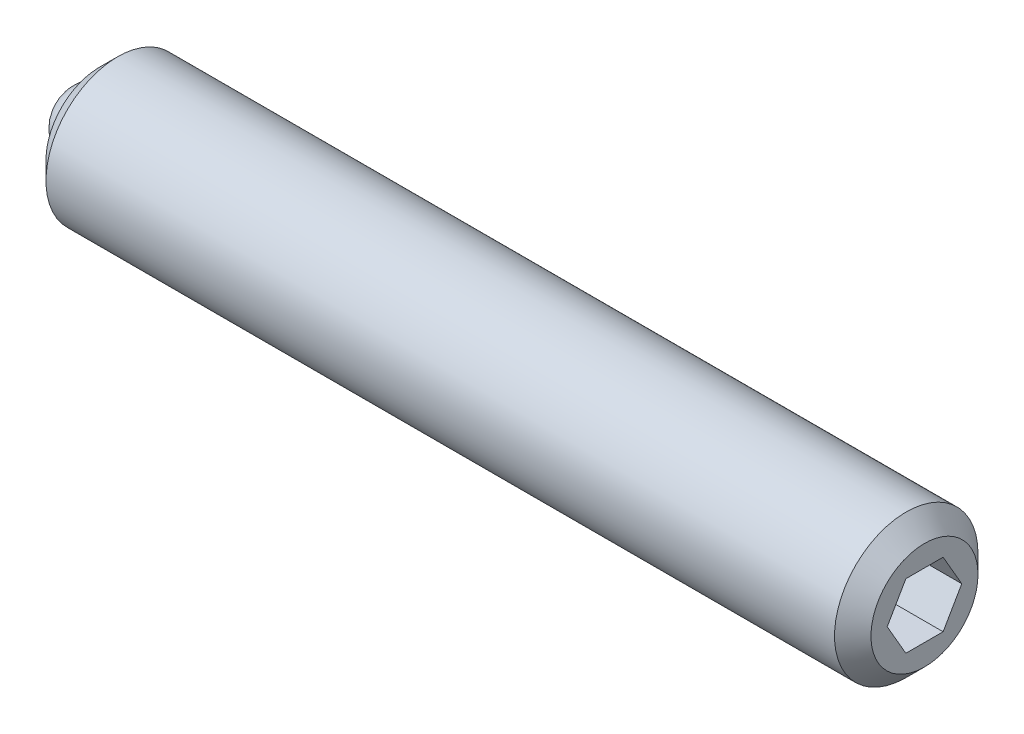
SolidWorks part; units mm, degrees
ref_plane "Front Plane" through (0, 0, 0) normal (0, 0, 1) x (1, 0, 0)
ref_plane "Top Plane" through (0, 0, 0) normal (0, 1, 0) x (1, 0, 0)
ref_plane "Right Plane" through (0, 0, 0) normal (1, 0, 0) x (0, 0, -1)
sketch "Sketch2" plane through (0, 0, 0) normal (1, 0, 0) x (0, 0, -1)
  circle A0 centre (0, 0) radius 1
  dimension "D1" = 2
extrude "Boss-Extrude1" add sketch "Sketch2" along normal blind 11.5
sketch "Sketch3" plane through (0, 0, 0) normal (-1, 0, 0) x (0, 0, 1)
  circle A0 centre (0, 0) radius 0.5
  dimension "D1" = 1
chamfer "Chamfer1" distance 0.254 angle 45 1 edges at (0, 0, -1)
chamfer "Chamfer2" distance 0.254 angle 45 1 edges at (11.5, 0, -1)
sketch "Sketch4" plane through (11.5, 0, 0) normal (1, 0, 0) x (0, 0, -1)
  line L1 (0.5196, 0) -> (0.2598, 0.45)
  line L2 (0.2598, 0.45) -> (-0.2598, 0.45)
  line L3 (-0.2598, 0.45) -> (-0.5196, 0)
  line L4 (-0.5196, 0) -> (-0.2598, -0.45)
  line L5 (-0.2598, -0.45) -> (0.2598, -0.45)
  line L6 (0.2598, -0.45) -> (0.5196, 0)
  circle A0 centre (0, 0) radius 0.45 construction
  dimension "D1" = 0.9
extrude "Cut-Extrude2" cut sketch "Sketch4" against normal blind 2
extrude "Cut-Extrude3" cut sketch "Sketch3" against normal blind 0.5
sketch "Sketch5" plane through (0, 0, 0) normal (-1, 0, 0) x (0, 0, 1)
  line L0 (0, 0) -> (0, -0.5)
  line L1 (0, 0) -> (0, 0.5)
  arc A0 (0, 0.5) -> (0, -0.5) centre (0, 0) ccw
  dimension "D1" = 0.5
revolve "Revolve1" add sketch "Sketch5" angle 360 about L1
